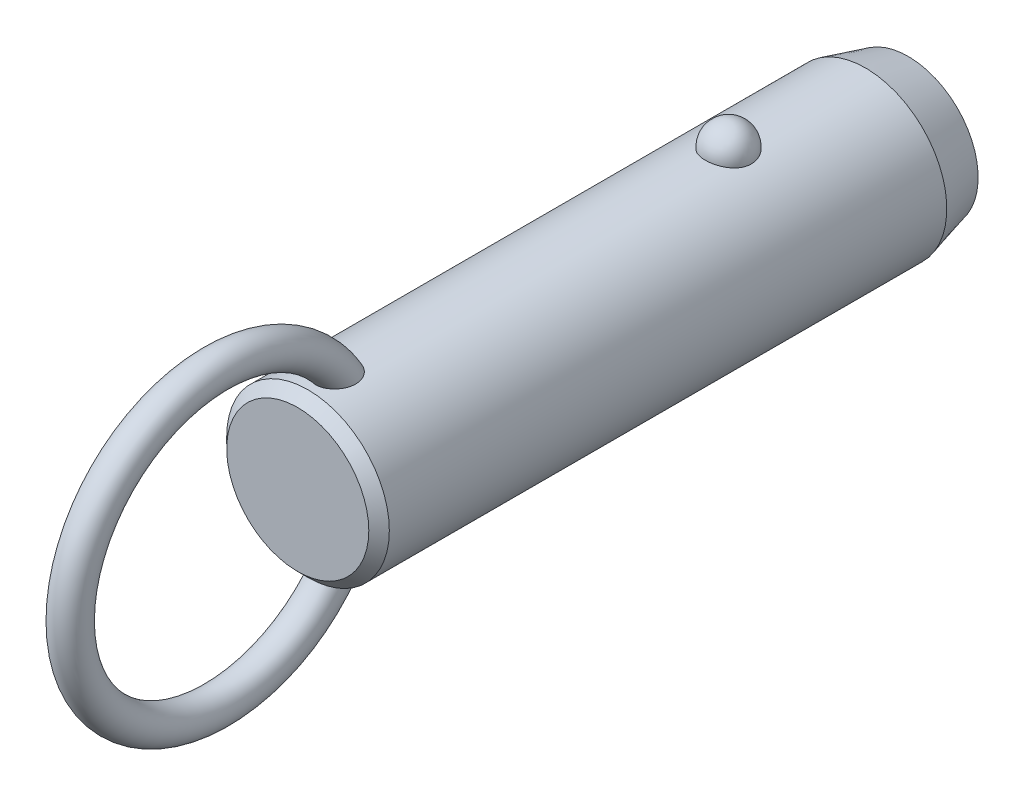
SolidWorks part; units mm, degrees
ref_plane "Front Plane" through (0, 0, 0) normal (0, 0, 1) x (1, 0, 0)
ref_plane "Top Plane" through (0, 0, 0) normal (0, 1, 0) x (1, 0, 0)
ref_plane "Right Plane" through (0, 0, 0) normal (1, 0, 0) x (0, 0, -1)
sketch "Sketch2" plane through (0, 0, 0) normal (0, 0, 1) x (1, 0, 0)
  circle A0 centre (0, 0) radius 9.5
  point P3 (0, 9.5)
  dimension "D1" = 19
extrude "Boss-Extrude1" add sketch "Sketch2" along normal blind 38.1
sketch "Sketch3" plane through (0, 0, 0) normal (0, 0, -1) x (-1, 0, 0)
  circle A0 centre (0, 0) radius 9.5
  dimension "D1" = 19
extrude "Boss-Extrude2" add sketch "Sketch3" along normal blind 23.7
chamfer "Chamfer1" distance 5 angle 15 1 edges at (-9.5, 0, -23.7)
sketch "Sketch12" plane through (0, 0, 0) normal (1, 0, 0) x (0, 0, -1)
  line L0 (-38.1, 9.5) -> (-38.1, -9.5) construction
  point P0 (-38.1, 0)
sketch "Sketch13" plane through (0, 0, 0) normal (1, 0, 0) x (0, 0, -1)
  circle A0 centre (-57.15, 0) radius 19.05
  point P2 (-38.1, 0)
  dimension "D1" = 38.1
sketch "Sketch14" plane through (0, 0, 0) normal (0, 1, 0) x (1, 0, 0)
  circle A0 centre (0, -40.1) radius 2
  point P2 (0, -38.1)
  dimension "D1" = 4
sweep "Sweep1" add profiles "Sketch14" path "Sketch13"
sketch "Sketch15" plane through (0, 0, 38.1) normal (0, 0, 1) x (1, 0, 0)
  circle A0 centre (0, 0) radius 9.5
  dimension "D1" = 19
extrude "Boss-Extrude3" add sketch "Sketch15" along normal blind 9.52
chamfer "Chamfer2" distance 1.2 angle 45 1 edges at (9.5, 0, 47.62)
sketch "Sketch18" plane through (0, 0, 0) normal (1, 0, 0) x (0, 0, -1)
  line L0 (18.7, 9.5) -> (-40.6378, 9.5) construction
  line L1 (2.7, 12.2) -> (2.7, 6.8)
  line L2 (-40.6378, -9.5) -> (18.7, -9.5) construction
  arc A0 (2.7, 12.2) -> (2.7, 6.8) centre (2.7, 9.5) ccw
  point P4 (0, 9.5)
  dimension "D1" = 21.7
revolve "Revolve1" add sketch "Sketch18" angle 360 about L1
